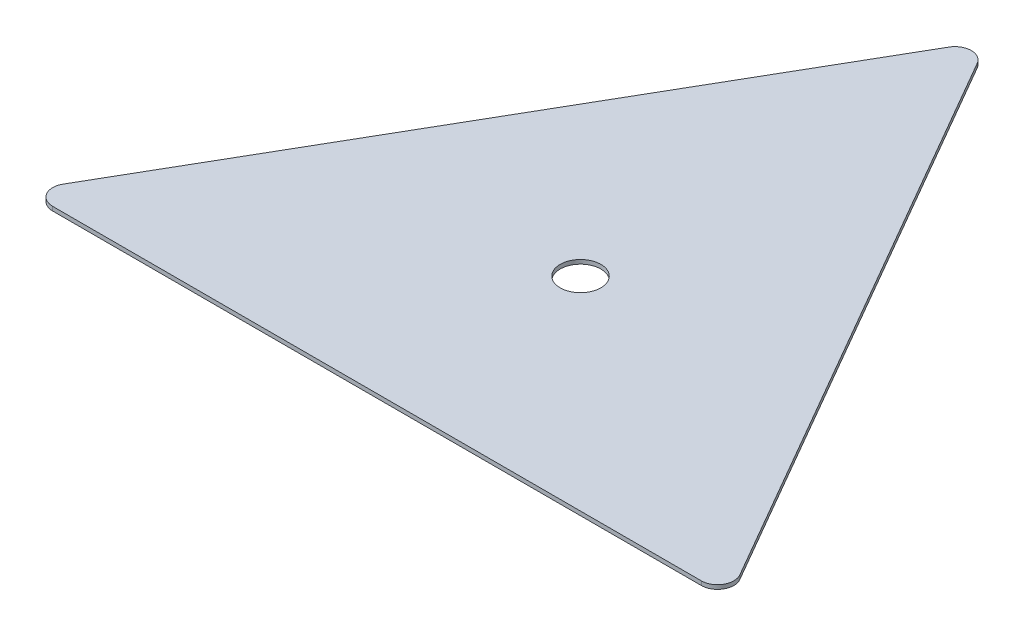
SolidWorks part; units mm, degrees
ref_plane "Plan de face" through (0, 0, 0) normal (0, 0, 1) x (1, 0, 0)
ref_plane "Plan de dessus" through (0, 0, 0) normal (0, 1, 0) x (1, 0, 0)
ref_plane "Plan de droite" through (0, 0, 0) normal (1, 0, 0) x (0, 0, -1)
sketch "Esquisse1" plane through (0, 0, 0) normal (0, 1, 0) x (1, 0, 0)
  line L0 (-39.2989, 50) -> (59.2636, 50) construction
  line L3 (0, 50) -> (-43.3013, -25)
  line L4 (-43.3013, -25) -> (43.3013, -25)
  line L5 (0, 50) -> (43.3013, -25)
  line L6 (0, 0) -> (68.357, 39.4659) construction
  line L7 (0, 0) -> (-63.4066, 36.6078) construction
  line L8 (-43.3013, -14.5081) -> (-43.3013, -36.1962) construction
  line L9 (-57.4914, -25.3522) -> (-36.6562, -25) construction
  circle A0 centre (0, 0) radius 50 construction
  circle A1 centre (0, 0) radius 2.5
  circle A2 centre (-18.1865, 10.5) radius 2.5 construction
  circle A3 centre (0, -21) radius 2.5 construction
  circle A4 centre (18.1865, 10.5) radius 2.5 construction
  point P12 (0, -25)
extrude "Extrusion1" add sketch "Esquisse1" against normal blind 0.5
fillet "Congé1" radius 2 3 edges at (43.3013, -0.25, 25) (-43.3013, -0.25, 25) (0, -0.25, -50)
